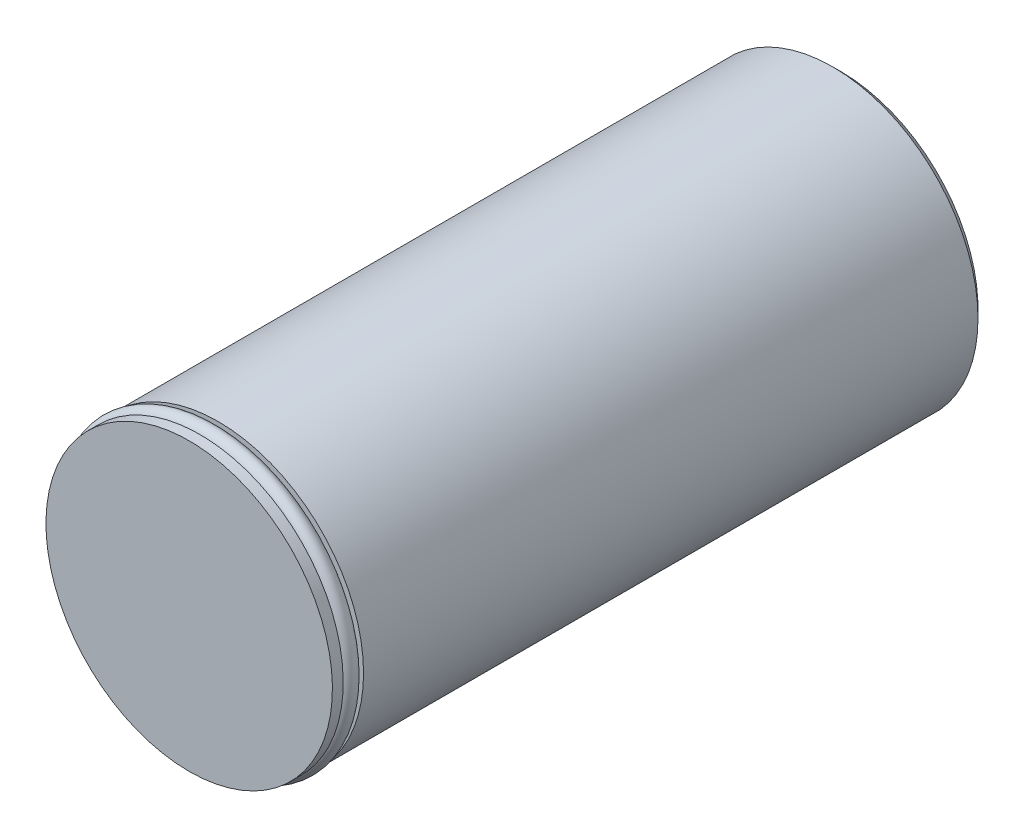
SolidWorks part; units mm, degrees
ref_plane "Front" through (0, 0, 0) normal (0, 0, 1) x (1, 0, 0)
ref_plane "Top" through (0, 0, 0) normal (0, 1, 0) x (1, 0, 0)
ref_plane "Right" through (0, 0, 0) normal (1, 0, 0) x (0, 0, -1)
imported_body "Imported1"
move or copy body "Body-Move/Copy1" bodies to move or copy 101 copy no translate (0, 0, 78.5)
